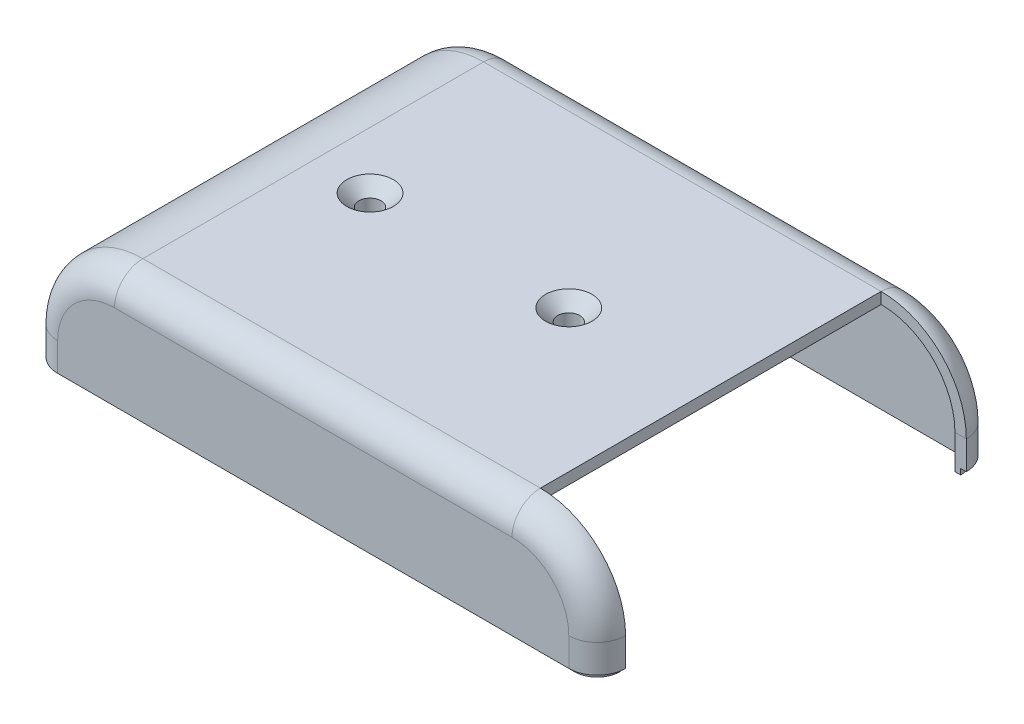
SolidWorks part; units mm, degrees
ref_plane "Front Plane" through (0, 0, 0) normal (0, 0, 1) x (1, 0, 0)
ref_plane "Top Plane" through (0, 0, 0) normal (0, 1, 0) x (1, 0, 0)
ref_plane "Right Plane" through (0, 0, 0) normal (1, 0, 0) x (0, 0, -1)
sketch "Sketch1" plane through (0, 0, 0) normal (0, 1, 0) x (1, 0, 0)
  line L1 (-50, -35) -> (50, -35)
  line L2 (-50, -35) -> (-50, 35)
  line L3 (-50, 35) -> (50, 35)
  line L4 (50, -35) -> (50, 35)
  line L5 (-50, -35) -> (50, 35) construction
  line L6 (-50, 35) -> (50, -35) construction
  point P0 (0, 0)
  dimension "D1" = 100
  dimension "D2" = 70
extrude "Boss-Extrude1" add sketch "Sketch1" along normal blind 20
fillet "Fillet1" radius 15 2 edges at (50, 20, 0) (-50, 20, 0)
fillet "Fillet2" radius 5 10 edges at (50, 2.5, -35) (45.6066, 15.6066, -35) (-50, 2.5, -35) (-45.6066, 15.6066, -35) (-50, 2.5, 35) (-45.6066, 15.6066, 35) (50, 2.5, 35) (45.6066, 15.6066, 35) (0, 20, -35) (0, 20, 35)
shell "Shell1" thickness 2
ref_plane "Plane1" through (0, 5, 0) normal (0, 1, 0) x (-1, 0, 0)
sketch "Sketch2" plane through (0, 5, 0) normal (0, 1, 0) x (-1, 0, 0)
  line L0 (50, 30) -> (50, -30) construction
  circle A0 centre (-10, 0) radius 3
  circle A1 centre (25, 0) radius 3
  dimension "D1" = 6
  dimension "D2" = 25
  dimension "D3" = 35
extrude "Boss-Extrude2" add sketch "Sketch2" along normal up to next draft 5
hole_wizard "CSK for M3.5 Flat Head Machine Screw1" positions "Sketch4" profile "Sketch3" countersink size "M3.5" standard "ANSI Metric"
sketch "Sketch4" plane through (0, 20, 0) normal (0, 1, 0) x (-1, 0, 0)
  circle A0 centre (25, 0) radius 4.1374 construction
  circle A1 centre (-10, 0) radius 4.1374 construction
  point P0 (-10, 0)
  point P1 (25, 0)
sketch "Sketch3" plane through (10, 20, 0) normal (1, 0, 0) x (0, 0, 1)
  line L0 (0, 0) -> (0, 20)
  line L1 (0, 20) -> (1.95, 20)
  line L2 (1.95, 20) -> (1.95, 2.15)
  line L3 (1.95, 2.15) -> (4.1, 0)
  line L5 (4.1, 0) -> (0, 0)
  line L6 (-1.95, 2.15) -> (-4.1, 0) construction
  line L11 (0, -6.35) -> (0, 107.95) construction
  dimension "Thru Hole Dia." = 3.9
  dimension "Thru Hole Depth" = 20
  dimension "Near C'Sink Dia." = 8.2
  dimension "Near C'Sink Angle" = 90
fillet "Fillet3" radius 1 2 edges at (-25, 18, -4.1374) (10, 18, -4.1374)
sketch "Sketch5" plane through (0, 0, 0) normal (0, -1, 0) x (1, 0, 0)
  line L5 (-48, -30) -> (-48, 30) construction
  line L6 (45, -33) -> (-45, -33) construction
  line L7 (-45, 33) -> (45, 33) construction
  line L8 (-48, -30) -> (-48, 30)
  line L9 (45, -33) -> (-45, -33)
  line L10 (-45, 33) -> (45, 33)
  arc A5 (-48, -30) -> (-45, -33) centre (-45, -30) ccw construction
  arc A6 (45, -33) -> (48, -30) centre (45, -30) ccw construction
  arc A7 (-45, 33) -> (-48, 30) centre (-45, 30) ccw construction
  arc A8 (48, 30) -> (45, 33) centre (45, 30) ccw construction
  arc A9 (-48, -30) -> (-45, -33) centre (-45, -30) ccw
  arc A10 (45, -33) -> (48, -30) centre (45, -30) ccw
  arc A11 (-45, 33) -> (-48, 30) centre (-45, 30) ccw
  arc A12 (48, 30) -> (45, 33) centre (45, 30) ccw
extrude "Extrude-Thin1" add sketch "Sketch5" along normal blind 1 thin
